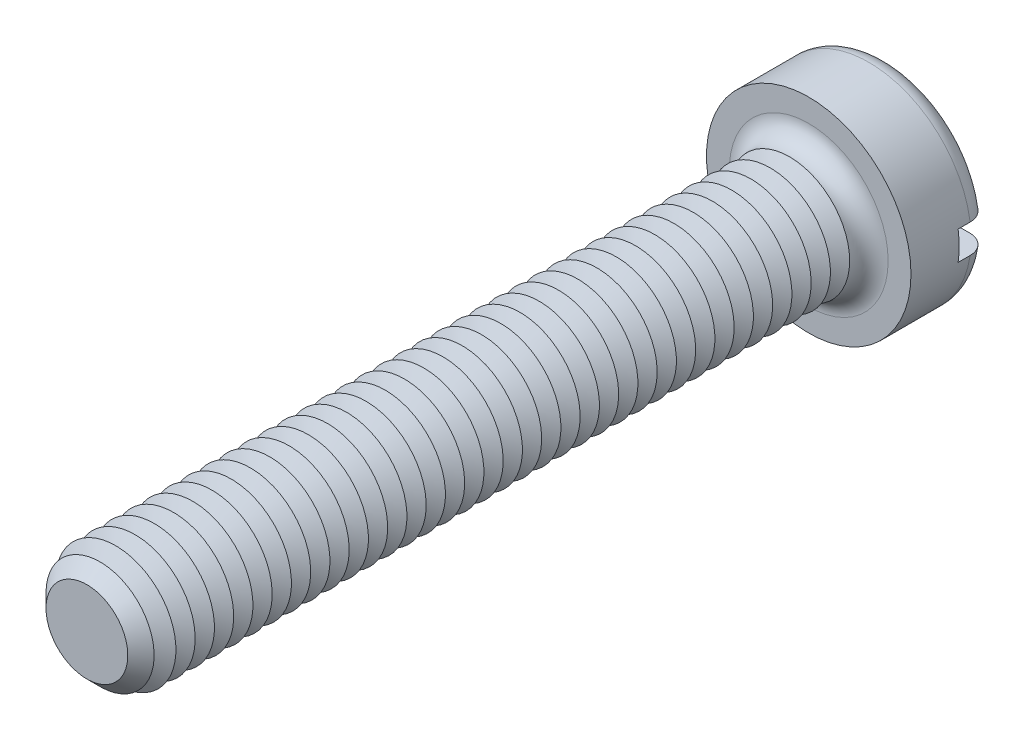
SolidWorks part; units mm, degrees
ref_plane "Front Plane" through (0, 0, 0) normal (0, 0, 1) x (1, 0, 0)
ref_plane "Top Plane" through (0, 0, 0) normal (0, 1, 0) x (1, 0, 0)
ref_plane "Right Plane" through (0, 0, 0) normal (1, 0, 0) x (0, 0, -1)
sketch "Sketch3" plane through (0, 0, 0) normal (0, 0, 1) x (1, 0, 0)
  circle A0 centre (0, 0) radius 4.25
  dimension "D1" = 8.5
extrude "Boss-Extrude2" add sketch "Sketch3" against normal blind 3.3
sketch "Sketch4" plane through (0, 0, 0) normal (0, 0, 1) x (1, 0, 0)
  circle A0 centre (0, 0) radius 2.5
  dimension "D1" = 5
extrude "Boss-Extrude3" add sketch "Sketch4" along normal blind 30
fillet "Fillet1" radius 0.8 2 edges at (4.25, 0, -3.3) (2.5, 0, 0)
chamfer "Chamfer1" distance 0.8 angle 45 1 edges at (2.5, 0, 30)
sketch "Sketch5" plane through (0, 0, 0) normal (1, 0, 0) x (0, 0, -1)
  line L0 (1.6944, 0) -> (-7.6738, 0) construction
sketch "Sketch6" plane through (0, 0, 0) normal (1, 0, 0) x (0, 0, -1)
  line L0 (-0.8, 2.5) -> (-1.2, 1.8072)
  line L1 (-1.2, 1.8072) -> (-1.6, 2.5)
  line L2 (-0.8, 2.5) -> (-29.2, 2.5) construction
  line L3 (-1.6, 2.5) -> (-0.8, 2.5)
  dimension "D1" = 0.8
revolve "Cut-Revolve1" cut sketch "Sketch6" angle 360 about L0
pattern_linear "LPattern1" count 36 spacing 0.8 along (0, 0, 1) of "Cut-Revolve1"
sketch "Sketch8" plane through (0, 0, -3.3) normal (0, 0, -1) x (-1, 0, 0)
  line L1 (4.25, -0.6) -> (-4.25, -0.6)
  line L2 (4.25, -0.6) -> (4.25, 0.6)
  line L3 (4.25, 0.6) -> (-4.25, 0.6)
  line L4 (-4.25, -0.6) -> (-4.25, 0.6)
  line L5 (4.25, -0.6) -> (-4.25, 0.6) construction
  line L6 (4.25, 0.6) -> (-4.25, -0.6) construction
  point P0 (0, 0)
  dimension "D1" = 8.5
  dimension "D2" = 1.2
extrude "Cut-Extrude1" cut sketch "Sketch8" against normal blind 1.3
